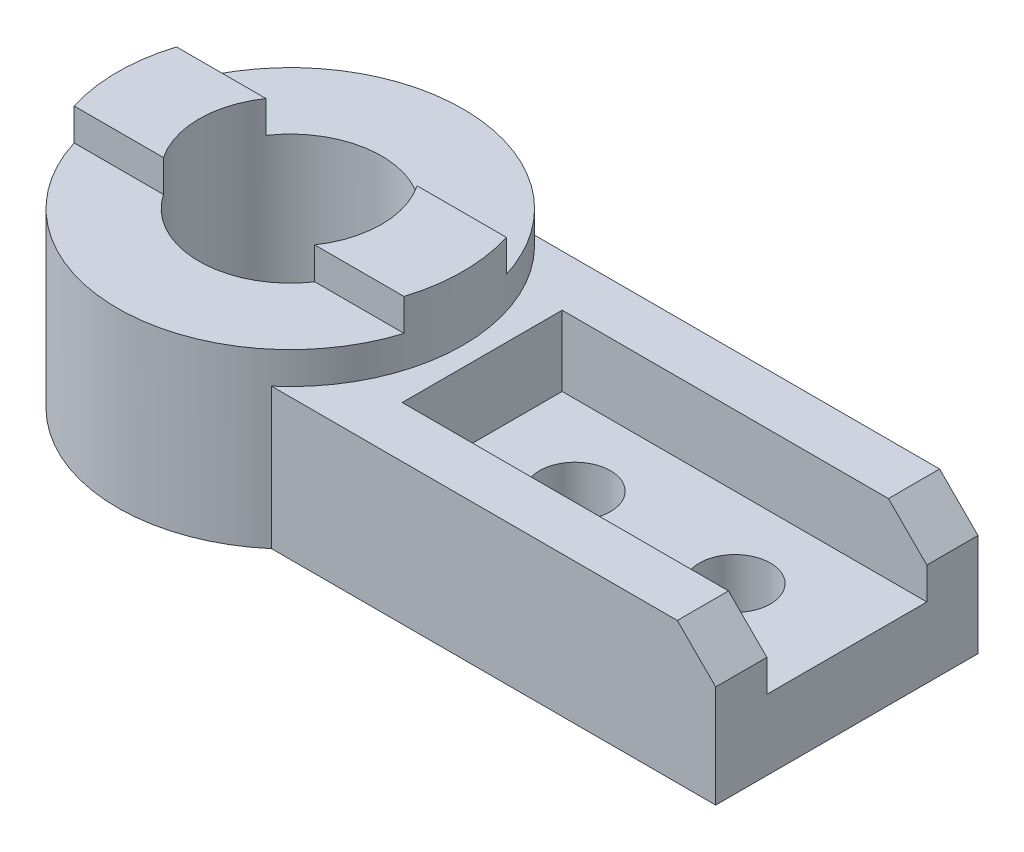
SolidWorks part; units mm, degrees
ref_plane "Front Plane" through (0, 0, 0) normal (0, 0, 1) x (1, 0, 0)
ref_plane "Top Plane" through (0, 0, 0) normal (0, 1, 0) x (1, 0, 0)
ref_plane "Right Plane" through (0, 0, 0) normal (1, 0, 0) x (0, 0, -1)
sketch "Sketch1" plane through (0, 0, 0) normal (0, 1, 0) x (1, 0, 0)
  line L0 (0, 0) -> (174, 0) construction
  line L1 (174, -41) -> (174, 41)
  line L2 (174, 41) -> (35.1426, 41)
  line L3 (174, -41) -> (35.1426, -41)
  arc A0 (35.1426, -41) -> (35.1426, 41) centre (0, 0) ccw
  circle A1 centre (89, 0) radius 11.1
  circle A2 centre (139, 0) radius 11.1
  point P7 (174, 0)
  dimension "D1" = 108
  dimension "D4" = 22.2
  dimension "D5" = 50
  dimension "D6" = 35
  dimension "D2" = 174
  dimension "D3" = 82
extrude "Boss-Extrude1" add sketch "Sketch1" along normal blind 44
sketch "Sketch2" plane through (0, 44, 0) normal (0, 1, 0) x (1, 0, 0)
  line L0 (174, -41) -> (174, 41) construction
  line L1 (60, 25) -> (174, 25)
  line L2 (60, 25) -> (60, -25)
  line L3 (60, -25) -> (174, -25)
  line L4 (174, 25) -> (174, -25)
  point P6 (174, 0)
  point P7 (174, 0)
  dimension "D1" = 114
  dimension "D2" = 50
extrude "Cut-Extrude1" cut sketch "Sketch2" against normal blind 22
sketch "Sketch3" plane through (0, 0, 41) normal (0, 0, 1) x (1, 0, 0)
  line L0 (174, 44) -> (174, 32)
  line L1 (174, 44) -> (174, 0) construction
  line L2 (174, 32) -> (162, 44)
  line L3 (162, 44) -> (174, 44)
  dimension "D1" = 45
  dimension "D2" = 12
extrude "Cut-Extrude2" cut sketch "Sketch3" against normal through all
sketch "Sketch4" plane through (0, 0, 0) normal (0, 1, 0) x (1, 0, 0)
  circle A0 centre (0, 0) radius 54
  circle A1 centre (0, 0) radius 28.55
  dimension "D1" = 108
  dimension "D2" = 57.1
extrude "Boss-Extrude2" add sketch "Sketch4" along normal blind 54
sketch "Sketch5" plane through (0, 54, 0) normal (0, 1, 0) x (1, 0, 0)
  line L0 (55.5375, 0) -> (-55.5375, 0) construction
  line L1 (51.5752, 16) -> (23.6453, 16)
  line L2 (51.5752, -16) -> (23.6453, -16)
  line L3 (-23.6453, -16) -> (-51.5752, -16)
  line L4 (55.5375, -16) -> (-55.5375, -16) construction
  line L5 (-23.6453, 16) -> (-51.5752, 16)
  line L6 (55.5375, 16) -> (-55.5375, 16) construction
  circle A0 centre (0, 0) radius 54 construction
  circle A1 centre (0, 0) radius 28.55 construction
  arc A2 (-51.5752, 16) -> (-51.5752, -16) centre (0, 0) ccw
  arc A3 (-23.6453, 16) -> (-23.6453, -16) centre (0, 0) ccw
  arc A4 (51.5752, -16) -> (51.5752, 16) centre (0, 0) ccw
  arc A5 (23.6453, -16) -> (23.6453, 16) centre (0, 0) ccw
  point P4 (0, 0)
  dimension "D1" = 16
  dimension "D2" = 16
extrude "Boss-Extrude3" add sketch "Sketch5" along normal blind 10
